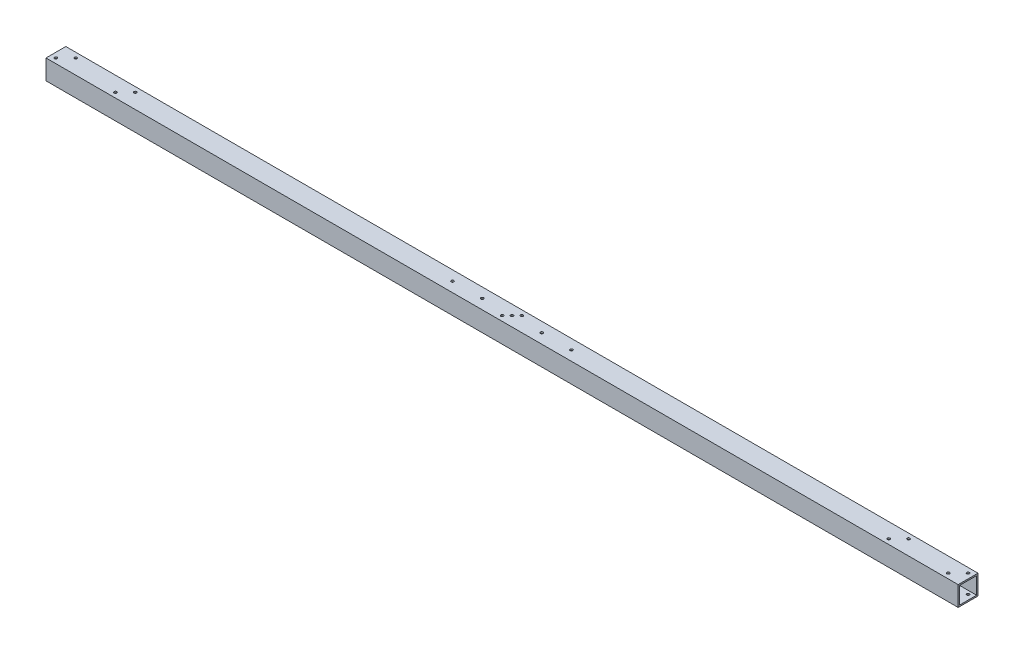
SolidWorks part; units mm, degrees
ref_plane "Front" through (0, 0, 0) normal (0, 0, 1) x (1, 0, 0)
ref_plane "Top" through (0, 0, 0) normal (0, 1, 0) x (1, 0, 0)
ref_plane "Right" through (0, 0, 0) normal (1, 0, 0) x (0, 0, -1)
sketch "Sketch1" plane through (0, 0, 0) normal (1, 0, 0) x (0, 0, -1)
  line L1 (0, 0) -> (50.8, 0)
  line L2 (0, 0) -> (0, 50.8)
  line L3 (0, 50.8) -> (50.8, 50.8)
  line L4 (50.8, 0) -> (50.8, 50.8)
  line L5 (3.6576, 47.1424) -> (47.1424, 47.1424)
  line L6 (3.6576, 47.1424) -> (3.6576, 3.6576)
  line L7 (3.6576, 3.6576) -> (47.1424, 3.6576)
  line L8 (47.1424, 47.1424) -> (47.1424, 3.6576)
  dimension "D1" = 50.8
  dimension "D2" = 50.8
  dimension "D3" = 3.6576
  dimension "D4" = 3.6576
  dimension "D5" = 3.6576
  dimension "D6" = 3.6576
extrude "Extrude1" add sketch "Sketch1" along normal blind 2336.8
sketch "Sketch3" plane through (0, 50.8, 0) normal (0, 1, 0) x (1, 0, 0)
  line L0 (0, 50.8) -> (0, 0) construction
  line L1 (0, 25.4) -> (2336.8, 25.4) construction
  line L2 (2336.8, 50.8) -> (2336.8, 0) construction
  line L3 (38.1, 38.1) -> (38.1, 25.4) construction
  line L4 (190.5, 45.2306) -> (190.5, 25.4) construction
  circle A0 centre (12.7, 12.7) radius 3.3731
  circle A1 centre (38.1, 38.1) radius 3.3731
  circle A2 centre (2324.1, 38.1) radius 3.3731
  circle A3 centre (2298.7, 12.7) radius 3.3731
  circle A4 centre (190.5, 38.1) radius 3.3731
  circle A5 centre (165.1, 12.7) radius 3.3731
  dimension "D1" = 6.7462
  dimension "D7" = 25.4
  dimension "D8" = 12.7
  dimension "D9" = 12.7
  dimension "D2" = 12.7
  dimension "D3" = 38.1
  dimension "D4" = 12.7
  dimension "D5" = 25.4
  dimension "D6" = 12.7
  dimension "D10" = 190.5
extrude "Cut-Extrude1" cut sketch "Sketch3" against normal through all
sketch "Sketch4" plane through (0, 0, 0) normal (0, -1, 0) x (1, 0, 0)
  circle A0 centre (1168.3989, -25.4) radius 3.3731
  circle A1 centre (1092.1989, -25.4) radius 3.3731
  circle A2 centre (1015.9989, -25.4) radius 3.3731
  circle A3 centre (1244.5989, -25.4) radius 3.3731
  circle A4 centre (1320.7989, -25.4) radius 3.3731
  dimension "D1" = 6.7462
extrude "Cut-Extrude2" cut sketch "Sketch4" against normal through all
sketch "Sketch5" plane through (0, 50.8, 0) normal (0, 1, 0) x (1, 0, 0)
  line L0 (1168.3989, 25.4) -> (1190.3516, 25.4) construction
  line L1 (1168.3989, 25.4) -> (1168.3989, 45.0672) construction
  line L2 (2146.3, 16.0731) -> (2146.3, 39.857) construction
  line L3 (2168.3269, 38.1) -> (2171.7, 38.1) construction
  line L4 (2171.7, 38.1) -> (2171.7, 12.7) construction
  line L5 (2146.3, 24.1288) -> (2159, 24.1288) construction
  line L6 (2159, 24.1288) -> (2159, 38.1) construction
  circle A0 centre (2146.3, 12.7) radius 3.3731
  circle A1 centre (2171.7, 38.1) radius 3.3731
  circle A5 centre (1155.6989, 12.7) radius 3.3731
  circle A6 centre (1181.0989, 38.1) radius 3.3731
  dimension "D2" = 12.7
  dimension "D4" = 12.7
  dimension "D1" = 12.7
  dimension "D3" = 12.7
extrude "Cut-Extrude3" cut sketch "Sketch5" against normal through all
